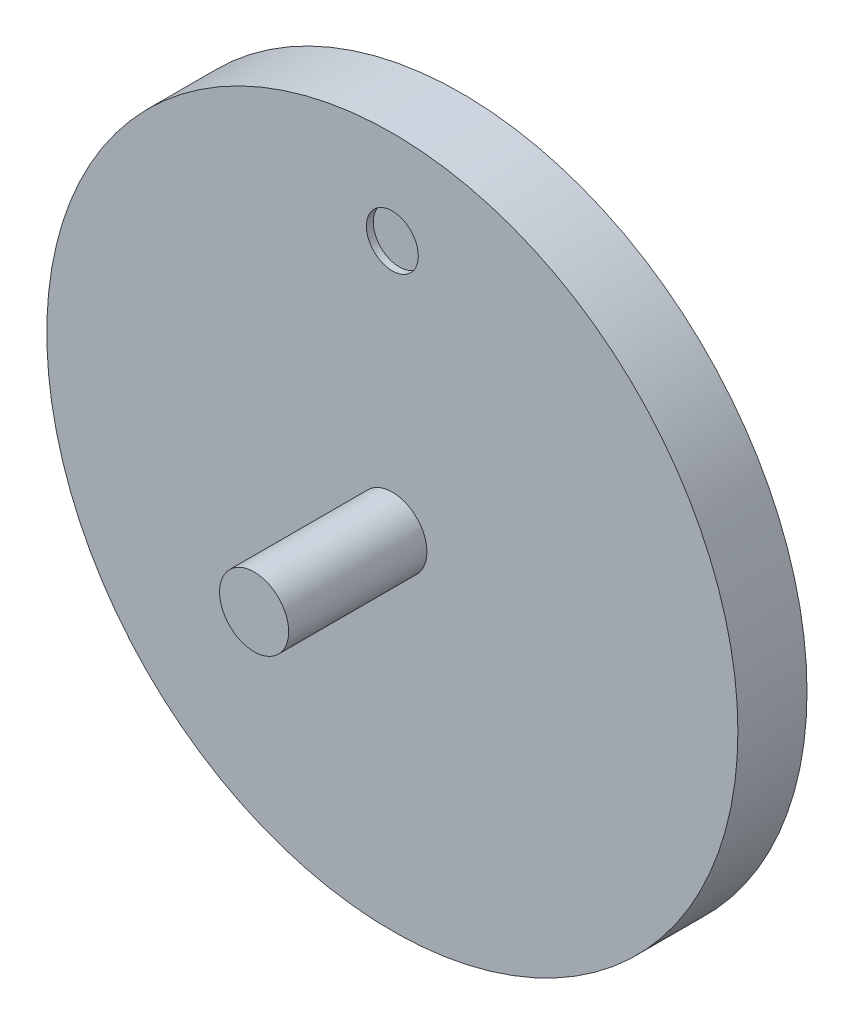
SolidWorks part; units mm, degrees
ref_plane "Plan de face" through (0, 0, 0) normal (0, 0, 1) x (1, 0, 0)
ref_plane "Plan de dessus" through (0, 0, 0) normal (0, 1, 0) x (1, 0, 0)
ref_plane "Plan de droite" through (0, 0, 0) normal (1, 0, 0) x (0, 0, -1)
sketch "Esquisse1" plane through (0, 0, 0) normal (0, 0, 1) x (1, 0, 0)
  circle A0 centre (0, 0) radius 500
extrude "Boss.-Extru.1" add sketch "Esquisse1" along normal blind 100
sketch "Esquisse4" plane through (0, 0, 100) normal (0, 0, 1) x (1, 0, 0)
  circle A0 centre (0, 0) radius 50
  dimension "D1" = 100
extrude "Boss.-Extru.2" add sketch "Esquisse4" along normal blind 200
sketch "Esquisse5" plane through (0, 0, 100) normal (0, 0, 1) x (1, 0, 0)
  circle A0 centre (0, 364.6794) radius 37.559
extrude "Enlèv. mat.-Extru.1" cut sketch "Esquisse5" against normal blind 10
